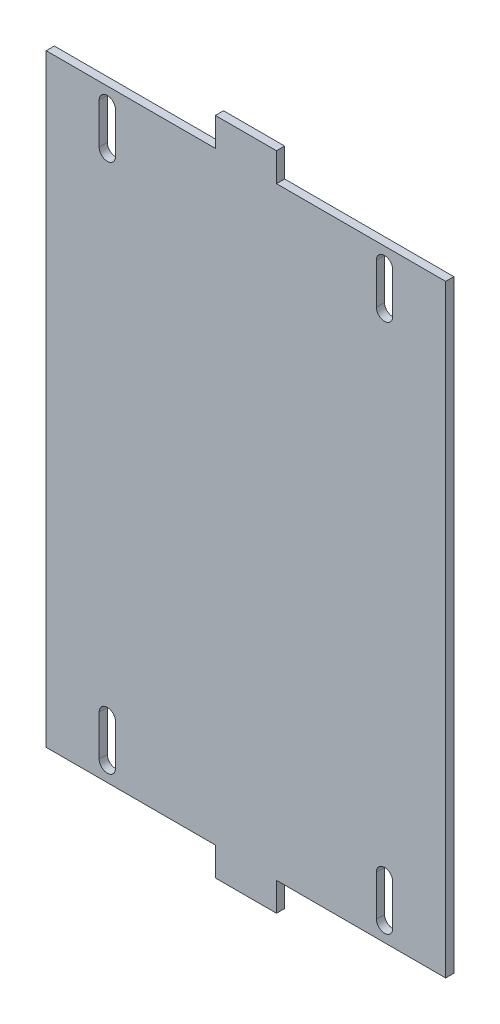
SolidWorks part; units mm, degrees
ref_plane "Plan de face" through (0, 0, 0) normal (0, 0, 1) x (1, 0, 0)
ref_plane "Plan de dessus" through (0, 0, 0) normal (0, 1, 0) x (1, 0, 0)
ref_plane "Plan de droite" through (0, 0, 0) normal (1, 0, 0) x (0, 0, -1)
sketch "Esquisse1" plane through (0, 0, 0) normal (0, 0, 1) x (1, 0, 0)
  line L0 (-66.0048, 0) -> (74.0054, 0) construction
  line L1 (0, 96.9396) -> (0, -89.5054) construction
  line L2 (-49, -74) -> (-49, 74)
  line L3 (-49, 74) -> (-7.5, 74)
  line L4 (-7.5, 74) -> (-7.5, 81)
  line L5 (-7.5, 81) -> (7.5, 81)
  line L6 (7.5, 74) -> (7.5, 81)
  line L7 (49, 74) -> (7.5, 74)
  line L8 (49, -74) -> (49, 74)
  line L9 (49, -74) -> (7.5, -74)
  line L10 (7.5, -74) -> (7.5, -81)
  line L11 (-7.5, -81) -> (7.5, -81)
  line L12 (-7.5, -74) -> (-7.5, -81)
  line L13 (-49, -74) -> (-7.5, -74)
  point P5 (0, -81)
  point P11 (0, 81)
  point P15 (49, 0)
  point P20 (-49, 0)
  dimension "D1" = 74
  dimension "D2" = 49
  dimension "D3" = 41.5
  dimension "D4" = 81
extrude "Extrusion1" add sketch "Esquisse1" along normal blind 2
sketch "Esquisse2" plane through (0, 0, 2) normal (0, 0, 1) x (1, 0, 0)
  line L0 (-34, 71.1798) -> (-34, 56.49) construction
  line L1 (-49, 74) -> (-49, -74) construction
  line L4 (-7.5, 74) -> (-49, 74) construction
  line L5 (-37.7127, 65) -> (-28.5415, 65) construction
  line L8 (-36, 70) -> (-36, 60)
  line L10 (-32, 70) -> (-32, 60)
  arc A0 (-36, 70) -> (-32, 70) centre (-34, 70) cw
  arc A1 (-36, 60) -> (-32, 60) centre (-34, 60) ccw
  dimension "D1" = 15
  dimension "D2" = 9
  dimension "D3" = 10
  dimension "D4" = 4
  dimension "D5" = 4
extrude "Enlèv. mat.-Extru.1" cut sketch "Esquisse2" against normal through all
pattern_linear "Répétition linéaire1" count 2 spacing 68 along (1, 0, 0) count 2 spacing 130 along (0, -1, 0) of "Enlèv. mat.-Extru.1"
